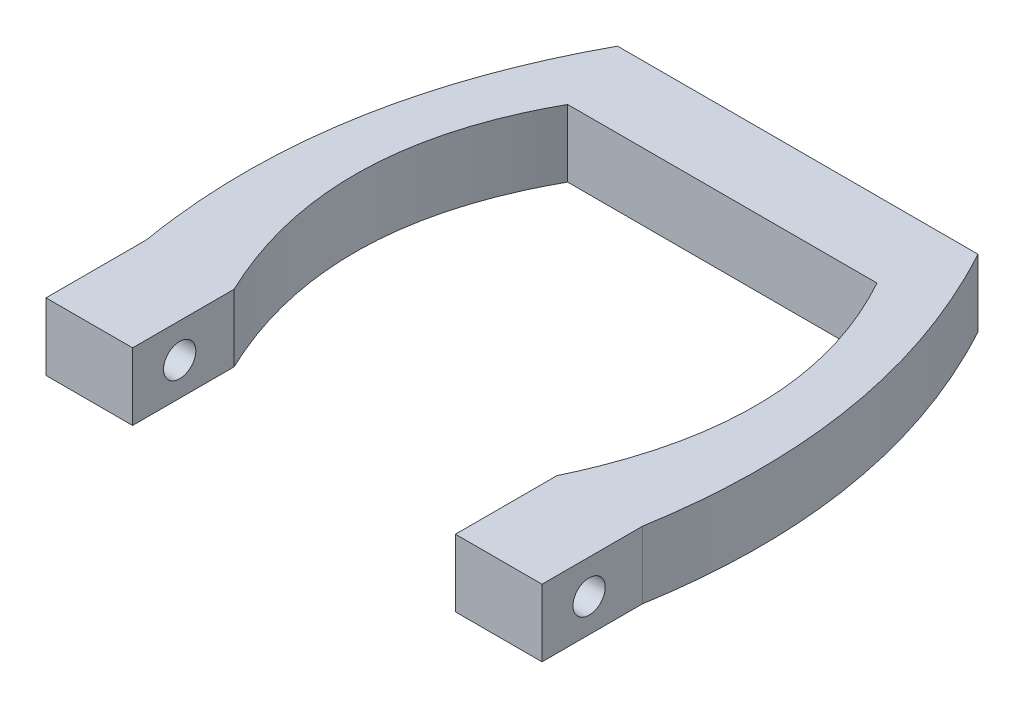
SolidWorks part; units mm, degrees
ref_plane "Спереди" through (0, 0, 0) normal (0, 0, 1) x (1, 0, 0)
ref_plane "Сверху" through (0, 0, 0) normal (0, 1, 0) x (1, 0, 0)
ref_plane "Справа" through (0, 0, 0) normal (1, 0, 0) x (0, 0, -1)
sketch "Эскиз1" plane through (0, 0, 0) normal (0, 1, 0) x (1, 0, 0)
  line L0 (-20.3998, -20.1172) -> (-13.9621, -20.1172)
  line L1 (-13.4615, 11.7242) -> (9.5385, 11.7242)
  line L2 (-13.9621, -20.1172) -> (-13.9621, -12.5715)
  line L3 (-1.9615, 11.7242) -> (-1.9615, -19.4537) construction
  line L4 (16.4768, -12.6407) -> (16.4768, -20.1172)
  line L5 (10.0391, -20.1172) -> (10.0391, -12.5715)
  line L6 (-20.3998, -12.6407) -> (-20.3998, -20.1172)
  line L7 (16.4768, -20.1172) -> (10.0391, -20.1172)
  line L8 (-15.3585, 17.3367) -> (11.4356, 17.3367)
  spline S0 degree 2 poles (-13.9621, -12.5715) (-19.9816, -0.0101) (-13.4615, 11.7242) knots 0 0 0 1 1 1
  spline S1 degree 2 poles (-20.3998, -12.6407) (-23.0659, 3.1679) (-15.3585, 17.3367) knots 0 0 0 1 1 1
  spline S2 degree 2 poles (16.4768, -12.6407) (19.143, 3.1679) (11.4356, 17.3367) knots 0 0 0 1 1 1
  spline S3 degree 2 poles (10.0391, -12.5715) (16.0587, -0.0101) (9.5385, 11.7242) knots 0 0 0 1 1 1
  dimension "D1" = 23
extrude "Бобышка-Вытянуть1" add sketch "Эскиз1" along normal blind 5
sketch "Эскиз2" plane through (-20.3998, 0, 0) normal (-1, 0, 0) x (0, 0, 1)
  line L0 (20.1172, 5) -> (20.1172, 0) construction
  circle A0 centre (16.6172, 2.4604) radius 1.2
  point P5 (20.1172, 2.5)
  dimension "D1" = 3.5
extrude "Вырез-Вытянуть1" cut sketch "Эскиз2" against normal blind 38
ref_plane "Плоскость2" through (-1.9615, 0, 0) normal (1, 0, 0) x (0, 0, -1)
sketch "Эскиз9" plane through (-1.9615, 0, 0) normal (1, 0, 0) x (0, 0, -1)
  line L0 (11.7242, 5) -> (11.7242, 0) construction
  spline S0 degree 3 poles (20.4067, 4.5715) (15.6446, 5.4018) (12.0185, 3.2992) (11.0329, 0.2327) (10.8216, -1.3491) (13.0044, -3.8319) (4.4497, -0.6542) (5.0405, 13.3439) (27.3204, 2.8817) (19.2211, -0.7931) (20.4067, 4.5715) (15.6446, 5.4018) (12.0185, 3.2992) knots -0.162313 -0.138581 -0.039019 0 0.136094 0.183681 0.200746 0.237526 0.328903 0.500841 0.837687 0.861419 0.960981 1 1.136094 1.183681 1.200746 only from (17.3367, 5) to (17.3367, 5)
